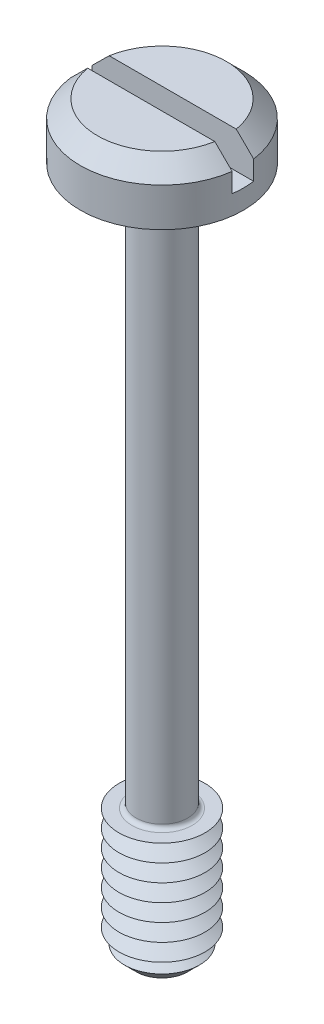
SolidWorks part; units mm, degrees
ref_plane "Front Plane" through (0, 0, 0) normal (0, 0, 1) x (1, 0, 0)
ref_plane "Top Plane" through (0, 0, 0) normal (0, 1, 0) x (1, 0, 0)
ref_plane "Right Plane" through (0, 0, 0) normal (1, 0, 0) x (0, 0, -1)
sketch "Sketch1" plane through (0, 0, 0) normal (0, 1, 0) x (1, 0, 0)
  circle A0 centre (0, 0) radius 1.9
  dimension "D1" = 3.8
extrude "Boss-Extrude1" add sketch "Sketch1" along normal blind 1.3
sketch "Sketch2" plane through (0, 0, 0) normal (0, -1, 0) x (1, 0, 0)
  circle A0 centre (0, 0) radius 0.6
  dimension "D1" = 1.2
extrude "Boss-Extrude2" add sketch "Sketch2" along normal blind 16
sketch "Sketch3" plane through (0, -16, 0) normal (0, -1, 0) x (1, 0, 0)
  circle A0 centre (0, 0) radius 1
  dimension "D1" = 2
extrude "Boss-Extrude3" add sketch "Sketch3" against normal blind 3
chamfer "Chamfer1" distance 0.4 angle 45 1 edges at (0, -16, -1)
sketch "Sketch4" plane through (0, 0, 0) normal (1, 0, 0) x (0, 0, -1)
  line L0 (0, -6.5871) -> (0, -12.0372) construction
sketch "Sketch5" plane through (0, 0, 0) normal (1, 0, 0) x (0, 0, -1)
  line L0 (-1, -13) -> (-0.6536, -13.2)
  line L1 (-0.6536, -13.2) -> (-1, -13.4)
  line L2 (-1, -13) -> (-1, -15.6) construction
  line L3 (-1, -13.4) -> (-1, -13)
  dimension "D1" = 0.4
revolve "Cut-Revolve1" cut sketch "Sketch5" angle 360 about L0
pattern_linear "LPattern1" count 7 spacing 0.4 along (0, -1, 0) of "Cut-Revolve1"
fillet "Fillet1" radius 0.1 2 edges at (0, -13, -0.6) (0, 0, -0.6)
chamfer "Chamfer2" distance 0.4 angle 45 1 edges at (0, 1.3, 1.9)
sketch "Sketch6" plane through (0, 1.3, 0) normal (0, 1, 0) x (1, 0, 0)
  line L1 (1.9, -0.25) -> (-1.9, -0.25)
  line L2 (1.9, -0.25) -> (1.9, 0.25)
  line L3 (1.9, 0.25) -> (-1.9, 0.25)
  line L4 (-1.9, -0.25) -> (-1.9, 0.25)
  line L5 (1.9, -0.25) -> (-1.9, 0.25) construction
  line L6 (1.9, 0.25) -> (-1.9, -0.25) construction
  circle A0 centre (0, 0) radius 1.9 construction
  point P0 (0, 0)
  dimension "D1" = 0.5
extrude "Cut-Extrude1" cut sketch "Sketch6" against normal blind 0.85
